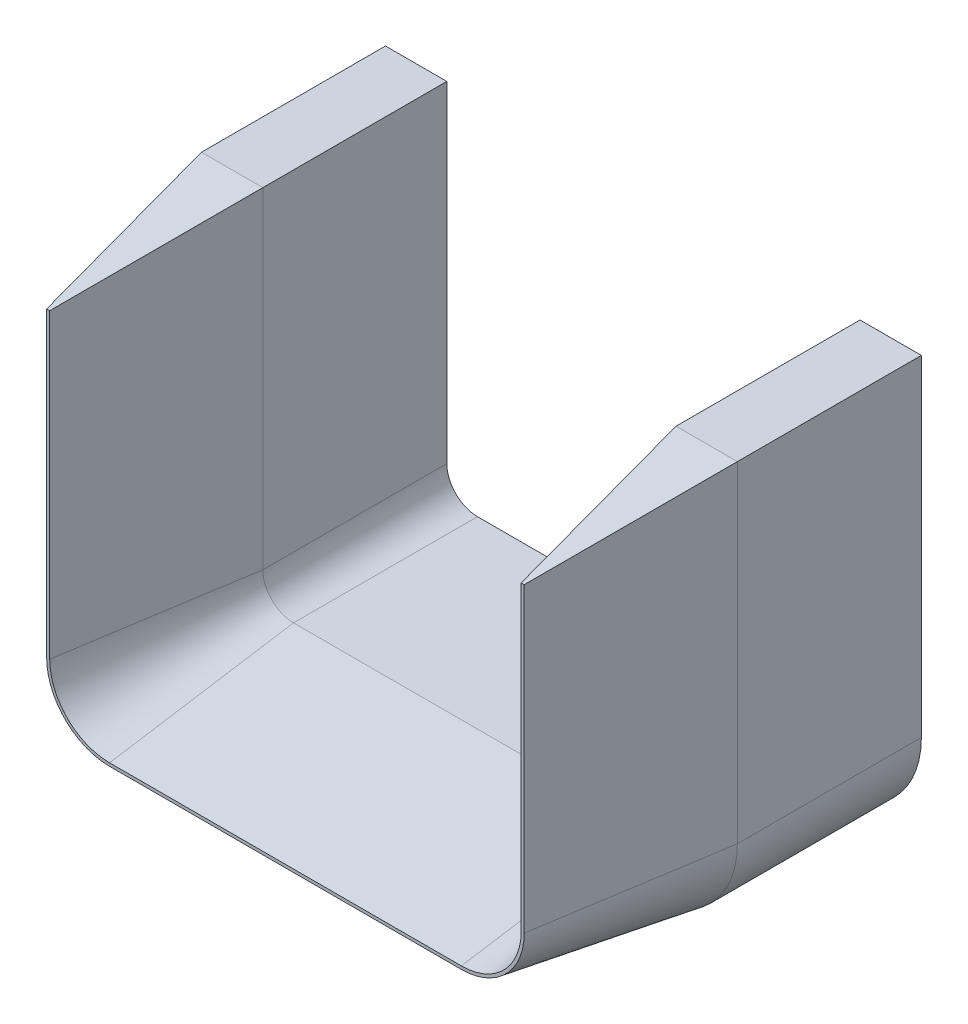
SolidWorks part; units mm, degrees
ref_plane "Front Plane" through (0, 0, 0) normal (0, 0, 1) x (1, 0, 0)
ref_plane "Top Plane" through (0, 0, 0) normal (0, 1, 0) x (1, 0, 0)
ref_plane "Right Plane" through (0, 0, 0) normal (1, 0, 0) x (0, 0, -1)
sketch "Sketch1" plane through (0, 0, 0) normal (0, 0, 1) x (1, 0, 0)
  line L2 (-38.2699, 24.9115) -> (-38.2699, -44.0465)
  line L3 (-38.2699, -44.0465) -> (49.101, -44.0465)
  line L4 (49.101, 24.9115) -> (49.101, -44.0465)
extrude "Extrude-Thin1" add sketch "Sketch1" along normal blind 30 draft 9 and the other way blind 30 thin
